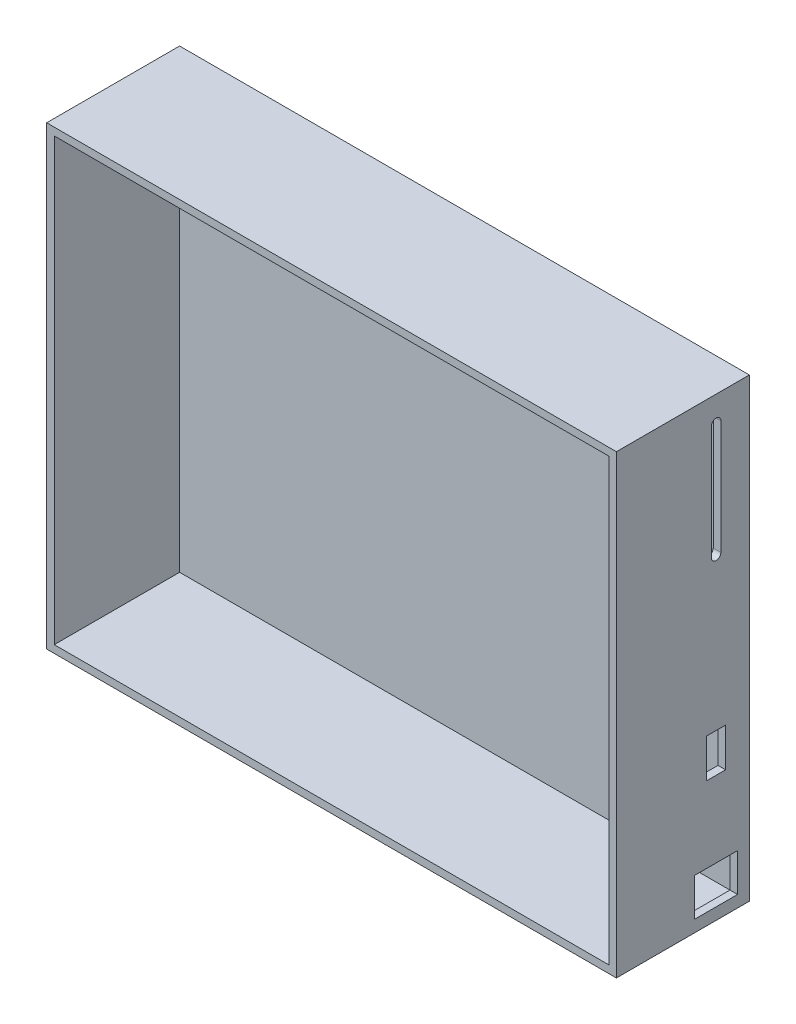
SolidWorks part; units mm, degrees
ref_plane "Front" through (0, 0, 0) normal (0, 0, 1) x (1, 0, 0)
ref_plane "Top" through (0, 0, 0) normal (0, 1, 0) x (1, 0, 0)
ref_plane "Right" through (0, 0, 0) normal (1, 0, 0) x (0, 0, -1)
sketch "Sketch1" plane through (0, 0, 0) normal (0, 0, 1) x (1, 0, 0)
  line L1 (95.25, -76.2) -> (-95.25, -76.2)
  line L2 (95.25, -76.2) -> (95.25, 76.2)
  line L3 (95.25, 76.2) -> (-95.25, 76.2)
  line L4 (-95.25, -76.2) -> (-95.25, 76.2)
  line L5 (95.25, -76.2) -> (-95.25, 76.2) construction
  line L6 (95.25, 76.2) -> (-95.25, -76.2) construction
  point P0 (0, 0)
  dimension "D1" = 152.4
  dimension "D2" = 190.5
extrude "Boss-Extrude1" add sketch "Sketch1" along normal mid plane 44.45
sketch "Sketch3" plane through (95.25, 0, 0) normal (1, 0, 0) x (0, 0, -1)
  line L0 (11.1125, 67.691) -> (11.1125, 29.591) construction
  line L5 (12.7, 67.691) -> (12.7, 29.591)
  line L6 (9.525, 67.691) -> (9.525, 29.591)
  line L9 (-22.225, -76.2) -> (22.225, -76.2) construction
  line L10 (22.225, -76.2) -> (22.225, 76.2) construction
  line L17 (7.9375, -21.209) -> (14.2875, -21.209)
  line L18 (7.9375, -21.209) -> (7.9375, -34.163)
  line L19 (7.9375, -34.163) -> (14.2875, -34.163)
  line L20 (14.2875, -21.209) -> (14.2875, -34.163)
  line L21 (7.9375, -21.209) -> (14.2875, -34.163) construction
  line L22 (7.9375, -34.163) -> (14.2875, -21.209) construction
  line L23 (3.937, -59.563) -> (18.288, -59.563)
  line L24 (3.937, -59.563) -> (3.937, -72.263)
  line L25 (3.937, -72.263) -> (18.288, -72.263)
  line L26 (18.288, -59.563) -> (18.288, -72.263)
  line L27 (3.937, -59.563) -> (18.288, -72.263) construction
  line L28 (3.937, -72.263) -> (18.288, -59.563) construction
  arc A0 (12.7, 67.691) -> (9.525, 67.691) centre (11.1125, 67.691) ccw
  arc A1 (9.525, 29.591) -> (12.7, 29.591) centre (11.1125, 29.591) ccw
  point P2 (11.1125, 48.641)
  point P5 (11.1125, -65.913)
  point P10 (86.6517, 16.6158)
  point P21 (11.1125, -27.686)
  point P33 (11.1125, -59.563)
  dimension "D4" = 50.8
  dimension "D2" = 3.175
  dimension "D3" = 38.1
  dimension "D8" = 14.351
  dimension "D9" = 12.7
  dimension "D10" = 3.937
  dimension "D11" = 3.937
  dimension "D12" = 25.4
  dimension "D13" = 12.954
  dimension "D14" = 6.35
shell "Shell1" thickness 2.54
extrude "Cut-Extrude1" cut sketch "Sketch3" against normal up to surface (2.54 mm away)
